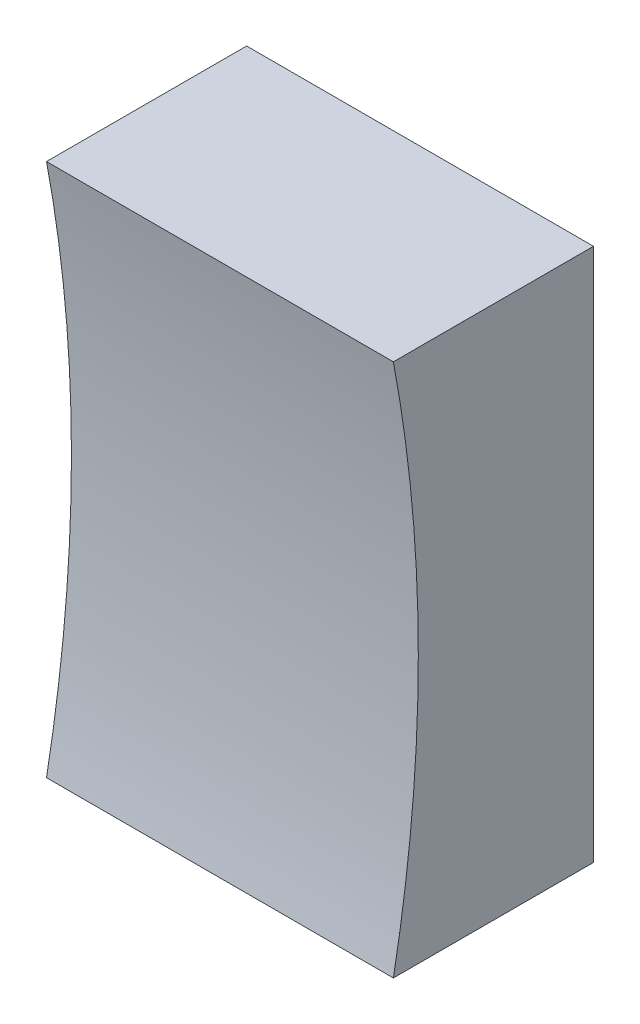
SolidWorks part; units mm, degrees
ref_plane "Front" through (0, 0, 0) normal (0, 0, 1) x (1, 0, 0)
ref_plane "Top" through (0, 0, 0) normal (0, 1, 0) x (1, 0, 0)
ref_plane "Right" through (0, 0, 0) normal (1, 0, 0) x (0, 0, -1)
sketch "Sketch1" plane through (0, 0, 0) normal (0, 0, 1) x (1, 0, 0)
  line L0 (-1.651, -2.54) -> (-1.651, 12.7) construction
  line L1 (-1.651, -2.54) -> (1.651, -2.54)
  line L2 (-1.651, -2.54) -> (-1.651, 2.54)
  line L3 (-1.651, 2.54) -> (1.651, 2.54)
  line L4 (1.651, -2.54) -> (1.651, 2.54)
  line L5 (-1.651, -2.54) -> (1.651, -2.54) construction
  line L6 (1.651, 12.7) -> (1.651, -2.54) construction
  point P6 (1.651, 0)
extrude "Extrude1" add sketch "Sketch1" along normal blind 1.905
sketch "Sketch2" plane through (1.651, 0, 0) normal (1, 0, 0) x (0, 0, -1)
  circle A0 centre (-15.3838, 0) radius 13.716
  dimension "D1" = 27.432
extrude "Cut-Extrude1" cut sketch "Sketch2" against normal through all
